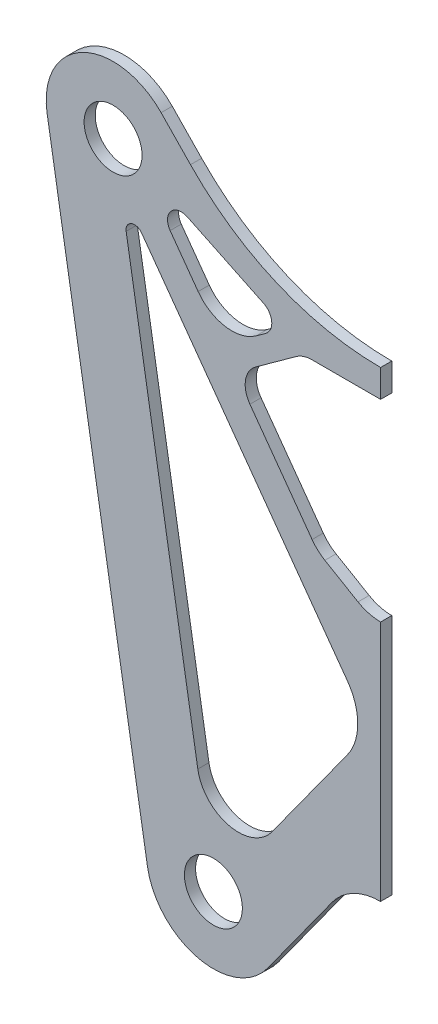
SolidWorks part; units mm, degrees
ref_plane "Ebene vorne" through (0, 0, 0) normal (0, 0, 1) x (1, 0, 0)
ref_plane "Ebene oben" through (0, 0, 0) normal (0, 1, 0) x (1, 0, 0)
ref_plane "Ebene rechts" through (0, 0, 0) normal (1, 0, 0) x (0, 0, -1)
sketch "Skizze1" plane through (0, 0, 0) normal (0, 0, 1) x (1, 0, 0)
  line L0 (-68.9175, 95.7966) -> (-68.9175, -338.76) construction
  line L1 (-218.5093, 29.3503) -> (-173.5093, -240.6497)
  line L2 (-167.3597, 55.1451) -> (-154.1877, 41.5345)
  line L3 (-119.5971, -253.2825) -> (-90.5829, -213.1089)
  line L4 (-68.9175, -7.0047) -> (-93.9175, -7.0047)
  line L5 (-68.9175, -7.0047) -> (-93.9175, -7.0047) construction
  line L6 (-93.9175, -7.0047) -> (-99.7671, -7.0047)
  line L7 (-193.8986, 41.1792) -> (1.1014, -228.8208) construction
  line L8 (-132.5327, -219.9542) -> (-83.8006, -152.4791) construction
  line L9 (-68.9175, -82.0047) -> (-93.9175, -82.0047) construction
  line L10 (-93.9175, -7.0047) -> (-93.9175, -82.0047) construction
  line L11 (-155.6442, 20.5496) -> (-121.4438, 4.0994)
  line L12 (51.0825, 34.2822) -> (-143.9175, -235.7178) construction
  line L13 (6.0825, -235.7178) -> (-188.9175, 34.2822) construction
  line L14 (-83.8006, -123.789) -> (-176.1645, 4.0994)
  line L15 (-117.6685, -199.3731) -> (-83.8006, -152.4791)
  line L16 (-183.0477, 1.2272) -> (-150.9127, -191.5833)
  line L17 (51.0825, 34.2822) -> (62.4673, 50.0458) construction
  line L18 (-120.4457, -7.1393) -> (-124.7203, -10.2265)
  line L19 (-150.7599, -6.0266) -> (-163.3251, 11.3714)
  line L20 (-197.092, 4.2534) -> (-158.5961, -226.7217) construction
  line L21 (-106.7128, -9.2507) -> (-124.9982, -22.4568)
  line L22 (-127.5349, -38.1842) -> (-99.6504, -76.7936)
  line L23 (-93.9175, -82.0047) -> (-79.0513, -90.7194)
  line L24 (-162.8882, 37.5797) -> (-112.021, 13.1129) construction
  line L25 (-155.1768, 0.0892) -> (-115.6953, -54.5775) construction
  line L26 (-68.9175, 5.3934) -> (-68.9175, -7.0047)
  line L27 (-68.9175, -93.4707) -> (-68.9175, -202.0312)
  circle A0 centre (-188.9175, 34.2822) radius 13
  arc A1 (-119.5971, -253.2825) -> (-173.5093, -240.6497) centre (-143.9175, -235.7178) cw
  circle A2 centre (-143.9175, -235.7178) radius 13
  arc A3 (-218.5093, 29.3503) -> (-167.3597, 55.1451) centre (-188.9175, 34.2822) cw
  arc A4 (-154.1877, 41.5345) -> (-68.9175, 5.3934) centre (-68.9175, 124.0561) ccw
  arc A5 (-90.5829, -213.1089) -> (-68.9175, -202.0312) centre (-68.9175, -228.7562) cw
  arc A6 (-99.7671, -7.0047) -> (-106.7128, -9.2507) centre (-99.7671, -18.8678) ccw
  arc A7 (-124.9982, -22.4568) -> (-127.5349, -38.1842) centre (-118.4029, -31.5888) ccw
  arc A8 (-121.4438, 4.0994) -> (-120.4457, -7.1393) centre (-124.2896, -1.817) cw
  arc A9 (-124.7203, -10.2265) -> (-150.7599, -6.0266) centre (-135.6401, 4.8933) cw
  arc A10 (-163.3251, 11.3714) -> (-155.6442, 20.5496) centre (-158.3202, 14.986) cw
  circle A11 centre (-188.9175, 34.2822) radius 30 construction
  circle A12 centre (-143.9175, -235.7178) radius 30 construction
  arc A13 (-83.8006, -152.4791) -> (-83.8006, -123.789) centre (-103.663, -138.134) ccw
  arc A14 (-150.9127, -191.5833) -> (-117.6685, -199.3731) centre (-132.6653, -188.5421) ccw
  arc A15 (-176.1645, 4.0994) -> (-183.0477, 1.2272) centre (-179.2696, 1.8568) ccw
  arc A16 (-99.6504, -76.7936) -> (-93.9175, -82.0047) centre (-84.4106, -65.7871) ccw
  arc A17 (-79.0513, -90.7194) -> (-68.9175, -93.4707) centre (-68.9175, -73.4322) ccw
  circle A18 centre (-139.7731, -33.7638) radius 7.3332 construction
  point P51 (-206.4822, 58.6026)
  point P52 (-161.4822, -260.0382)
  point P55 (-156.2443, -208.3673)
  point P57 (-162.0669, 20.9014)
  point P60 (-188.9175, 47.2822)
  point P62 (-143.9175, -248.7178)
  dimension "D7" = 30
  dimension "D4" = 25
  dimension "D1" = 120
  dimension "D2" = 75
  dimension "D3" = 270
  dimension "D5" = 75
  dimension "D6" = 30
  dimension "D8" = 13
  dimension "D9" = 13
extrude "Aufsatz-Linear austragen1" add sketch "Skizze1" along normal blind 5
ref_plane "Ebene1" through (-140.6089, 0, 0) normal (1, 0, 0) x (0, 0, -1)
